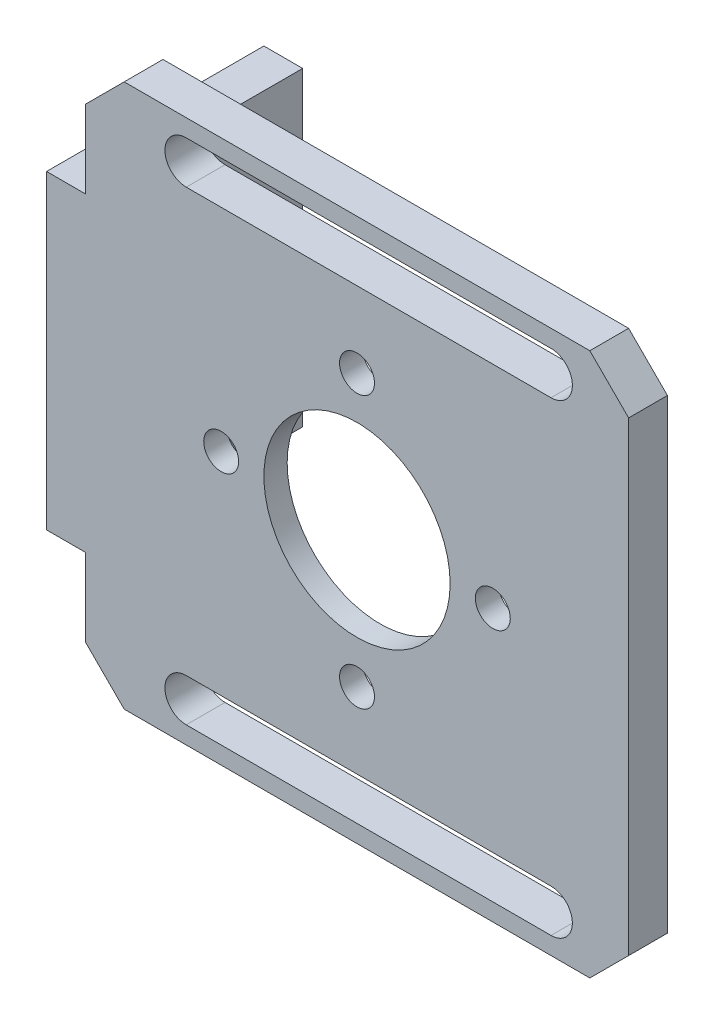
SolidWorks part; units mm, degrees
ref_plane "Plan de face" through (0, 0, 0) normal (0, 0, 1) x (1, 0, 0)
ref_plane "Plan de dessus" through (0, 0, 0) normal (0, 1, 0) x (1, 0, 0)
ref_plane "Plan de droite" through (0, 0, 0) normal (1, 0, 0) x (0, 0, -1)
sketch "Esquisse1" plane through (0, 0, 0) normal (0, 0, 1) x (1, 0, 0)
  line L0 (50.2549, 0) -> (-45.9898, 0) construction
  line L1 (-35, 35) -> (35, 35)
  line L2 (-35, 35) -> (-35, -35)
  line L3 (-35, -35) -> (35, -35)
  line L4 (35, 35) -> (35, -35)
  line L5 (-22, 32.75) -> (25, 32.75)
  line L6 (-22, -27.25) -> (25, -27.25)
  line L7 (-22, 27.25) -> (25, 27.25)
  line L8 (-22, -32.75) -> (25, -32.75)
  arc A0 (-22, 32.75) -> (-22, 27.25) centre (-22, 30) ccw
  arc A1 (25, 32.75) -> (25, 27.25) centre (25, 30) cw
  arc A2 (25, -32.75) -> (25, -27.25) centre (25, -30) ccw
  arc A3 (-22, -32.75) -> (-22, -27.25) centre (-22, -30) cw
  dimension "D1" = 70
  dimension "D2" = 70
  dimension "D3" = 35
  dimension "D4" = 35
  dimension "D5" = 10
  dimension "D6" = 5.5
  dimension "D7" = 30
  dimension "D8" = 47
extrude "Extrusion1" add sketch "Esquisse1" along normal blind 5
chamfer "Chanfrein1" distance 5 angle 45 4 edges at (-35, 35, 2.5) (-35, -35, 2.5) (35, -35, 2.5) (35, 35, 2.5)
sketch "Esquisse2" plane through (0, 0, 0) normal (0, 0, -1) x (-1, 0, 0)
  line L0 (35, 30) -> (35, -30) construction
  line L1 (35, -20) -> (40, -20)
  line L2 (35, -20) -> (35, 20)
  line L3 (35, 20) -> (40, 20)
  line L4 (40, -20) -> (40, 20)
  dimension "D1" = 5
  dimension "D2" = 20
  dimension "D3" = 40
extrude "Extrusion2" add sketch "Esquisse2" along normal blind 23 and the other way blind 5
sketch "Esquisse3" plane through (-35, 0, 0) normal (1, 0, 0) x (0, 0, -1)
  line L0 (0, -30) -> (0, 30) construction
  circle A0 centre (14, 0) radius 3.25
  dimension "D1" = 6.5
  dimension "D2" = 14
extrude "Enlèv. mat.-Extru.1" cut sketch "Esquisse3" against normal through all
sketch "Esquisse4" plane through (0, 0, 5) normal (0, 0, 1) x (1, 0, 0)
  circle A0 centre (0, 0) radius 12
  dimension "D1" = 24
extrude "Enlèv. mat.-Extru.2" cut sketch "Esquisse4" against normal through all
sketch "Esquisse5" plane through (0, 0, 0) normal (0, 0, -1) x (-1, 0, 0)
  circle A0 centre (0, 0) radius 23.5
  dimension "D1" = 47
extrude "Enlèv. mat.-Extru.3" cut sketch "Esquisse5" against normal blind 2
sketch "Esquisse6" plane through (0, 0, 5) normal (0, 0, 1) x (1, 0, 0)
  circle A0 centre (0, -17.5) radius 2.25
  dimension "D1" = 4.5
  dimension "D2" = 17.5
extrude "Enlèv. mat.-Extru.4" cut sketch "Esquisse6" against normal through all
pattern_circular "Répétition circulaire1" count 4 every 90 about axis through (0, 0, 0) along (0, 0, 1) of "Enlèv. mat.-Extru.4"
